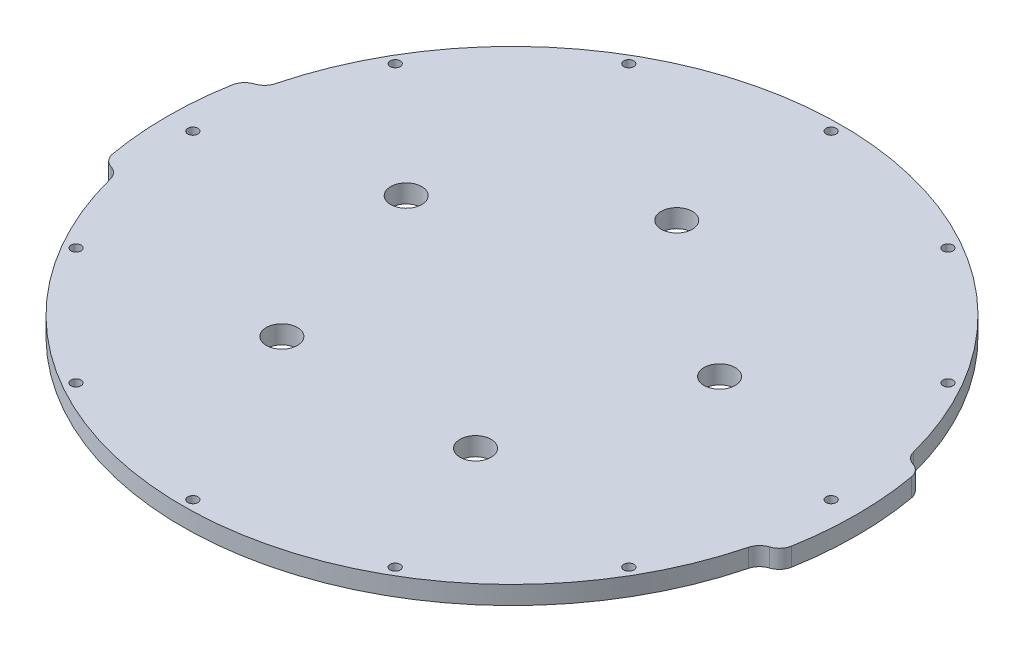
SolidWorks part; units mm, degrees
ref_plane "Front Plane" through (0, 0, 0) normal (0, 0, 1) x (1, 0, 0)
ref_plane "Top Plane" through (0, 0, 0) normal (0, 1, 0) x (1, 0, 0)
ref_plane "Right Plane" through (0, 0, 0) normal (1, 0, 0) x (0, 0, -1)
sketch "Sketch1" plane through (0, 0, 0) normal (0, 1, 0) x (1, 0, 0)
  line L0 (0, 0) -> (-111.234, 19.6136) construction
  line L1 (0, 0) -> (-139.7786, 0) construction
  line L2 (0, 0) -> (-111.234, -19.6136) construction
  line L3 (0, 0) -> (111.234, 19.6136) construction
  line L4 (0, 0) -> (111.234, -19.6136) construction
  circle A0 centre (0, 0) radius 104.55 construction
  circle A1 centre (0, 104.55) radius 1.65
  circle A2 centre (52.275, 90.543) radius 1.65
  circle A3 centre (90.543, 52.275) radius 1.65
  circle A4 centre (104.55, 0) radius 1.65
  circle A5 centre (90.543, -52.275) radius 1.65
  circle A6 centre (52.275, -90.543) radius 1.65
  circle A7 centre (0, -104.55) radius 1.65
  circle A8 centre (-52.275, -90.543) radius 1.65
  circle A9 centre (-90.543, -52.275) radius 1.65
  circle A10 centre (-104.55, 0) radius 1.65
  circle A11 centre (-90.543, 52.275) radius 1.65
  circle A12 centre (-52.275, 90.543) radius 1.65
  circle A13 centre (0, 0) radius 107.95 construction
  circle A14 centre (0, 0) radius 112.95 construction
  arc A15 (-111.234, -19.6136) -> (-111.234, 19.6136) centre (0, 0) cw
  arc A16 (111.234, -19.6136) -> (111.234, 19.6136) centre (0, 0) ccw
  arc A17 (-111.234, -19.6136) -> (-105.328, -23.6479) centre (-106.31, -18.7453) ccw
  arc A18 (-111.234, 19.6136) -> (-105.328, 23.6479) centre (-106.31, 18.7453) cw
  arc A19 (111.234, -19.6136) -> (105.328, -23.6479) centre (106.31, -18.7453) cw
  arc A20 (111.234, 19.6136) -> (105.328, 23.6479) centre (106.31, 18.7453) ccw
  arc A21 (-105.328, 23.6479) -> (105.328, 23.6479) centre (0, 0) cw
  arc A22 (105.328, -23.6479) -> (-105.328, -23.6479) centre (0, 0) cw
  point P30 (0, 0)
  dimension "D1" = 3.3
  dimension "D2" = 209.1
  dimension "D4" = 215.9
  dimension "D5" = 5
  dimension "D6" = 10
  dimension "D3" = 12
extrude "Boss-Extrude1" add sketch "Sketch1" along normal blind 6
fillet "Fillet1" radius 5 4 edges at (105.328, 3, 23.6479) (105.328, 3, -23.6479) (-105.328, 3, -23.6479) (-105.328, 3, 23.6479)
sketch "Sketch2" plane through (0, 6, 0) normal (0, 1, 0) x (1, 0, 0)
  line L0 (0, 0) -> (0, -107.95) construction
  circle A0 centre (0, 53.975) radius 5.1
  circle A1 centre (0, 0) radius 53.975 construction
  circle A2 centre (51.3333, 16.6792) radius 5.1
  circle A3 centre (31.7257, -43.6667) radius 5.1
  circle A4 centre (-31.7257, -43.6667) radius 5.1
  circle A5 centre (-51.3333, 16.6792) radius 5.1
  arc A6 (-104.514, -27.019) -> (104.514, -27.019) centre (0, 0) ccw construction
  point P5 (0, -53.975)
  point P16 (0, 0)
  dimension "D1" = 10.2
  dimension "D2" = 5
extrude "Cut-Extrude1" cut sketch "Sketch2" against normal through all
